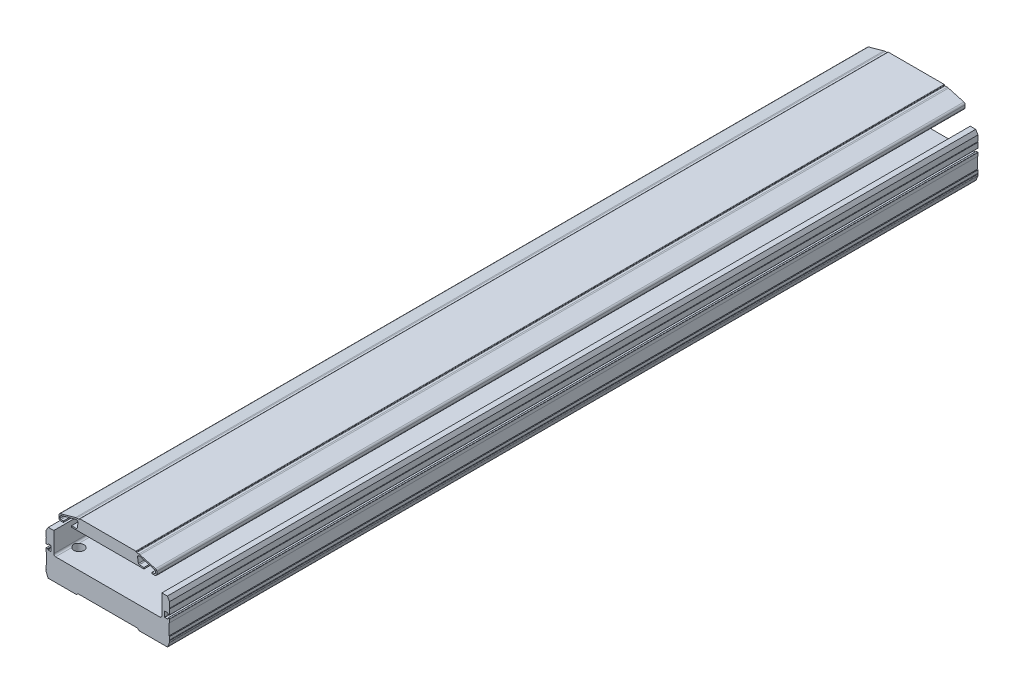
SolidWorks part; units mm, degrees
ref_plane "前视基准面" through (0, 0, 0) normal (0, 0, 1) x (1, 0, 0)
ref_plane "上视基准面" through (0, 0, 0) normal (0, 1, 0) x (1, 0, 0)
ref_plane "右视基准面" through (0, 0, 0) normal (1, 0, 0) x (0, 0, -1)
sketch "草图1" plane through (0, 0, 0) normal (0, 0, 1) x (1, 0, 0)
  line B0 (30.5, 71.9) -> (-30.5, 71.9)
  line B1 (-31.5, 70.9) -> (-33.9122, 70.9)
  line B2 (-35.2622, 70.7143) -> (-52.04, 66.0094)
  line B3 (-53.5, 64.0837) -> (-53.5, 61.4)
  line B4 (-51.5, 59.4) -> (-48.5, 59.4)
  line B5 (-48.5, 59.4) -> (-48.5, 60.9)
  line B6 (-48.5, 60.9) -> (-51, 60.9)
  line B7 (-52, 61.9) -> (-52, 63.7046)
  line B8 (-51.27, 64.6675) -> (-35.0485, 69.2164)
  line B9 (-32.5361, 66.9593) -> (-33.4138, 61.7343)
  line B10 (-34.4, 60.9) -> (-39.5, 60.9)
  line B11 (-39.5, 60.9) -> (-39.5, 59.4)
  line B12 (-39.5, 59.4) -> (39.5, 59.4)
  line B13 (39.5, 59.4) -> (39.5, 60.9)
  line B14 (39.5, 60.9) -> (34.4, 60.9)
  line B15 (33.4138, 61.7343) -> (32.5361, 66.9593)
  line B16 (35.0485, 69.2164) -> (51.27, 64.6675)
  line B17 (52, 63.7046) -> (52, 61.9)
  line B18 (51, 60.9) -> (48.5, 60.9)
  line B19 (48.5, 60.9) -> (48.5, 59.4)
  line B20 (48.5, 59.4) -> (51.5, 59.4)
  line B21 (53.5, 61.4) -> (53.5, 64.0837)
  line B22 (52.04, 66.0094) -> (35.2622, 70.7143)
  line B23 (33.9122, 70.9) -> (31.5, 70.9)
  line B24 (57, 22.7) -> (-57, 22.7)
  line B25 (-59, 24.7) -> (-59, 46.6)
  line B26 (-59, 46.6) -> (-65, 46.6)
  line B27 (-65, 46.6) -> (-67.5, 42.6)
  line B28 (-67.5, 42.6) -> (-67.5, 36.375)
  line B29 (-67.5, 35.625) -> (-67.5, 30.1)
  line B30 (-67.2, 29.8) -> (-65.8, 29.8)
  line B31 (-65.5, 30.1) -> (-65.5, 30.7)
  line B32 (-65.2, 31) -> (-62.3, 31)
  line B33 (-62, 30.7) -> (-62, 25.3)
  line B34 (-62.3, 25) -> (-65.2, 25)
  line B35 (-65.5, 25.3) -> (-65.5, 25.9)
  line B36 (-65.8, 26.2) -> (-67.2, 26.2)
  line B37 (-67.5, 25.9) -> (-67.5, 22.5)
  line B38 (-67.5, 22.5) -> (-67, 22)
  line B39 (-67, 22) -> (-67, 10)
  line B40 (-67, 10) -> (-67.5, 9.5)
  line B41 (-67.5, 9.5) -> (-67.5, 6.375)
  line B42 (-67.5, 5.625) -> (-67.5, 4.382)
  line B43 (-67.3599, 3.6465) -> (-65.5064, -1.0289)
  line B44 (-65.16, -1.6) -> (-34.1, -1.6)
  line B45 (-34.1, -1.6) -> (-32.5, 0)
  line B46 (-32.5, 0) -> (32.5, 0)
  line B47 (32.5, 0) -> (34.1, -1.6)
  line B48 (34.1, -1.6) -> (65.16, -1.6)
  line B49 (65.5064, -1.0289) -> (67.3604, 3.6478)
  line B50 (67.5, 4.3813) -> (67.5, 5.625)
  line B51 (67.5, 6.375) -> (67.5, 9.5)
  line B52 (67.5, 9.5) -> (67, 10)
  line B53 (67, 10) -> (67, 22)
  line B54 (67, 22) -> (67.5, 22.5)
  line B55 (67.5, 22.5) -> (67.5, 25.9)
  line B56 (67.2, 26.2) -> (65.8, 26.2)
  line B57 (65.5, 25.9) -> (65.5, 25.3)
  line B58 (65.2, 25) -> (62.3, 25)
  line B59 (62, 25.3) -> (62, 30.7)
  line B60 (62.3, 31) -> (65.2, 31)
  line B61 (65.5, 30.7) -> (65.5, 30.1)
  line B62 (65.8, 29.8) -> (67.2, 29.8)
  line B63 (67.5, 30.1) -> (67.5, 35.625)
  line B64 (67.5, 36.375) -> (67.5, 42.6)
  line B65 (67.5, 42.6) -> (65, 46.6)
  line B66 (65, 46.6) -> (59, 46.6)
  line B67 (59, 46.6) -> (59, 24.7)
  arc B68 (31, 71.4) -> (31.5, 70.9) centre (31.5, 71.4) ccw
  arc B69 (31, 71.4) -> (30.5, 71.9) centre (30.5, 71.4) ccw
  arc B70 (-30.5, 71.9) -> (-31, 71.4) centre (-30.5, 71.4) ccw
  arc B71 (-31.5, 70.9) -> (-31, 71.4) centre (-31.5, 71.4) ccw
  arc B72 (-33.9122, 70.9) -> (-35.2622, 70.7143) centre (-33.9122, 65.9) ccw
  arc B73 (-52.04, 66.0094) -> (-53.5, 64.0837) centre (-51.5, 64.0837) ccw
  arc B74 (-53.5, 61.4) -> (-51.5, 59.4) centre (-51.5, 61.4) ccw
  arc B75 (-52, 61.9) -> (-51, 60.9) centre (-51, 61.9) ccw
  arc B76 (-51.27, 64.6675) -> (-52, 63.7046) centre (-51, 63.7046) ccw
  arc B77 (-32.5361, 66.9593) -> (-35.0485, 69.2164) centre (-34.5085, 67.2906) ccw
  arc B78 (-34.4, 60.9) -> (-33.4138, 61.7343) centre (-34.4, 61.9) ccw
  arc B79 (33.4138, 61.7343) -> (34.4, 60.9) centre (34.4, 61.9) ccw
  arc B80 (35.0485, 69.2164) -> (32.5361, 66.9593) centre (34.5085, 67.2906) ccw
  arc B81 (52, 63.7046) -> (51.27, 64.6675) centre (51, 63.7046) ccw
  arc B82 (51, 60.9) -> (52, 61.9) centre (51, 61.9) ccw
  arc B83 (51.5, 59.4) -> (53.5, 61.4) centre (51.5, 61.4) ccw
  arc B84 (53.5, 64.0837) -> (52.04, 66.0094) centre (51.5, 64.0837) ccw
  arc B85 (35.2622, 70.7143) -> (33.9122, 70.9) centre (33.9122, 65.9) ccw
  arc B86 (-59, 24.7) -> (-57, 22.7) centre (-57, 24.7) ccw
  arc B87 (-67.5, 35.625) -> (-67.5, 36.375) centre (-67.5, 36) ccw
  arc B88 (-67.5, 30.1) -> (-67.2, 29.8) centre (-67.2, 30.1) ccw
  arc B89 (-65.8, 29.8) -> (-65.5, 30.1) centre (-65.8, 30.1) ccw
  arc B90 (-65.2, 31) -> (-65.5, 30.7) centre (-65.2, 30.7) ccw
  arc B91 (-62, 30.7) -> (-62.3, 31) centre (-62.3, 30.7) ccw
  arc B92 (-62.3, 25) -> (-62, 25.3) centre (-62.3, 25.3) ccw
  arc B93 (-65.5, 25.3) -> (-65.2, 25) centre (-65.2, 25.3) ccw
  arc B94 (-65.5, 25.9) -> (-65.8, 26.2) centre (-65.8, 25.9) ccw
  arc B95 (-67.2, 26.2) -> (-67.5, 25.9) centre (-67.2, 25.9) ccw
  arc B96 (-67.5, 5.625) -> (-67.5, 6.375) centre (-67.5, 6) ccw
  arc B97 (-67.5, 4.382) -> (-67.3599, 3.6465) centre (-65.5, 4.382) ccw
  arc B98 (-65.5064, -1.0289) -> (-65.16, -1.6) centre (-63.6472, -0.2918) ccw
  arc B99 (65.16, -1.6) -> (65.5064, -1.0289) centre (63.6472, -0.2918) ccw
  arc B100 (67.3604, 3.6478) -> (67.5, 4.3813) centre (65.5, 4.382) ccw
  arc B101 (67.5, 6.375) -> (67.5, 5.625) centre (67.5, 6) ccw
  arc B102 (67.5, 25.9) -> (67.2, 26.2) centre (67.2, 25.9) ccw
  arc B103 (65.8, 26.2) -> (65.5, 25.9) centre (65.8, 25.9) ccw
  arc B104 (65.2, 25) -> (65.5, 25.3) centre (65.2, 25.3) ccw
  arc B105 (62, 25.3) -> (62.3, 25) centre (62.3, 25.3) ccw
  arc B106 (62.3, 31) -> (62, 30.7) centre (62.3, 30.7) ccw
  arc B107 (65.5, 30.7) -> (65.2, 31) centre (65.2, 30.7) ccw
  arc B108 (65.5, 30.1) -> (65.8, 29.8) centre (65.8, 30.1) ccw
  arc B109 (67.2, 29.8) -> (67.5, 30.1) centre (67.2, 30.1) ccw
  arc B110 (67.5, 36.375) -> (67.5, 35.625) centre (67.5, 36) ccw
  arc B111 (57, 22.7) -> (59, 24.7) centre (57, 24.7) ccw
sketch_block_instance "块2-1"
sketch_block "块2"
extrude "凸台-拉伸1" add sketch "草图1" along normal blind 833
hole_wizard "打孔尺寸(%根据)内六角圆柱头螺钉的类型1" positions "草图7" profile "草图5" counterbore size "M6" standard "GB"
sketch "草图7" plane through (0, 46.6, 0) normal (0, 1, 0) x (1, 0, 0)
  line L0 (0, 0) -> (0, -383.8232) construction
  line L2 (30.5, 0) -> (-30.5, 0) construction
  point P0 (-53, -61.5)
  point P8 (-53, -211.5)
  point P10 (-53, -1011.5)
  point P12 (-53, -611.5)
  point P14 (-53, -411.5)
  point P16 (-53, -1211.5)
  point P18 (-53, -811.5)
  point P34 (53, -811.5)
  point P35 (53, -1211.5)
  point P36 (53, -411.5)
  point P37 (53, -611.5)
  point P38 (53, -1011.5)
  point P39 (53, -211.5)
  point P40 (53, -61.5)
  dimension "D1" = 106
  dimension "D2" = 61.5
  dimension "D3" = 150
  dimension "D4" = 200
  dimension "D5" = 200
  dimension "D6" = 200
  dimension "D7" = 200
  dimension "D8" = 200
sketch "草图5" plane through (-53, 46.6, 61.5) normal (1, 0, 0) x (0, 0, 1)
  line L0 (0, 0) -> (0, 48.2)
  line L1 (0, 48.2) -> (3.3, 48.2)
  line L3 (3.3, 48.2) -> (3.3, 40.9)
  line L4 (3.3, 40.9) -> (5.5, 40.9)
  line L5 (5.5, 40.9) -> (5.5, 0)
  line L7 (5.5, 0) -> (0, 0)
  line L11 (0, -6.35) -> (0, 107.95) construction
  dimension "通孔孔直径" = 6.6
  dimension "通孔孔深度" = 48.2
  dimension "柱形沉头孔直径" = 11
  dimension "柱形沉头孔深度" = 40.9
hole_wizard "M6 螺纹孔1" positions "草图8" profile "草图9" tap size "M6" standard "GB"
sketch "草图8" plane through (0, -1.6, 0) normal (0, -1, 0) x (-1, 0, 0)
  line L0 (0, 0) -> (0, -43.6644) construction
  line L2 (-34.1, 0) -> (-65.16, 0) construction
  point P0 (-53, -51.5)
  point P7 (53, -51.5)
  point P10 (-53, -201.5)
  point P12 (-53, -401.5)
  point P14 (-53, -601.5)
  point P18 (-53, -801.5)
  point P20 (-53, -1001.5)
  point P21 (53, -1001.5)
  point P22 (53, -801.5)
  point P23 (53, -601.5)
  point P24 (53, -401.5)
  point P25 (53, -201.5)
  point P28 (-53, -1201.5)
  point P34 (53, -1201.5)
  dimension "D1" = 106
  dimension "D2" = 51.5
  dimension "D3" = 150
  dimension "D4" = 200
  dimension "D5" = 200
  dimension "D6" = 200
  dimension "D7" = 200
  dimension "D8" = 200
sketch "草图9" plane through (53, -1.6, 51.5) normal (1, 0, 0) x (0, 0, -1)
  line L0 (0, 0) -> (0, 12.5022)
  line L1 (0, 12.5022) -> (2.5, 11)
  line L2 (2.5, 11) -> (2.5, 0)
  line L5 (2.5, 0) -> (0, 0)
  line L10 (0, 12.5022) -> (-2.5, 11) construction
  line L11 (0, -6.35) -> (0, 107.95) construction
  dimension "螺纹孔钻头直径" = 5
  dimension "螺纹孔钻头深度" = 11
  dimension "导头角度" = 118
